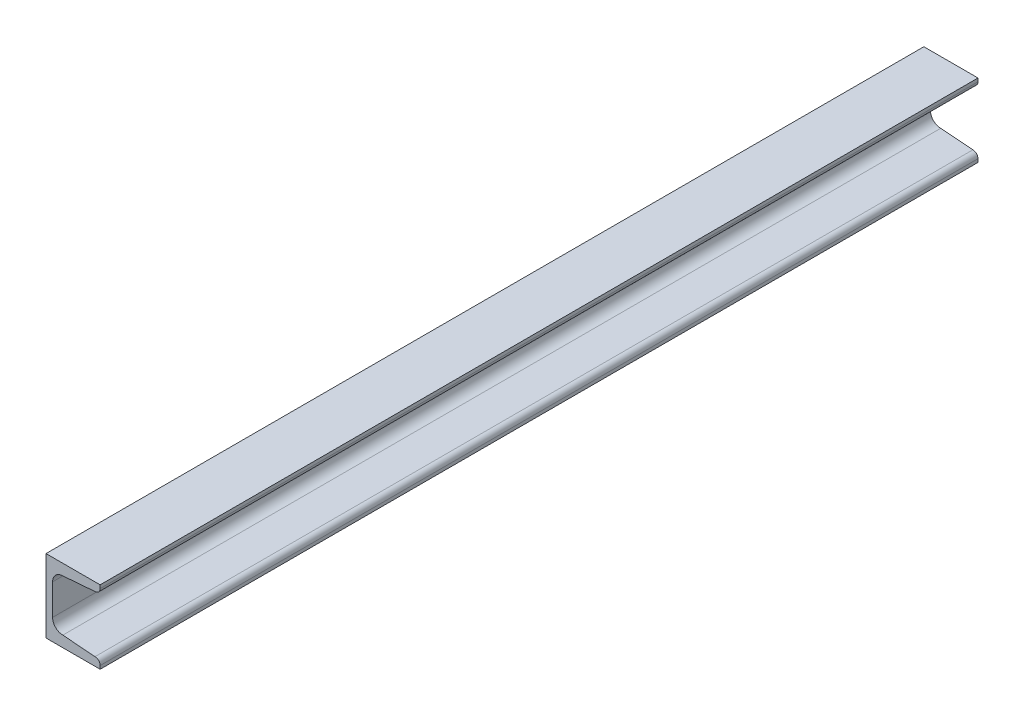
SolidWorks part; units mm, degrees
ref_plane "前视基准面" through (0, 0, 0) normal (0, 0, 1) x (1, 0, 0)
ref_plane "上视基准面" through (0, 0, 0) normal (0, 1, 0) x (1, 0, 0)
ref_plane "右视基准面" through (0, 0, 0) normal (1, 0, 0) x (0, 0, -1)
sketch "草图1" plane through (0, 0, 0) normal (0, 0, 1) x (1, 0, 0)
  line L0 (0, 0) -> (0, 50)
  line L1 (0, 25) -> (0, 0)
  line L2 (37, 0) -> (37, 2.225)
  line L3 (37, 2.225) -> (37, 0)
  line L4 (0, 0) -> (37, 0)
  line L5 (0, 25) -> (4.5, 25) construction
  line L6 (4.5, 35.525) -> (4.5, 14.475)
  line L7 (11.5, 7.475) -> (33.5, 5.725)
  line L8 (0, 50) -> (37, 50)
  line L9 (37, 50) -> (37, 47.775)
  line L10 (11.5, 42.525) -> (33.5, 44.275)
  arc A0 (4.5, 14.475) -> (11.5, 7.475) centre (11.5, 14.475) ccw
  arc A1 (37, 2.225) -> (33.5, 5.725) centre (33.5, 2.225) ccw
  arc A2 (37, 47.775) -> (33.5, 44.275) centre (33.5, 47.775) cw
  arc A3 (4.5, 35.525) -> (11.5, 42.525) centre (11.5, 35.525) cw
  point P5 (7, 0)
  point P7 (3.0436, 0)
  point P20 (8.7686, 0)
  point P21 (0, 4.1903)
  point P22 (0, 3.7153)
  point P23 (-11.2467, 57.0208)
  point P25 (-12.5718, 7.0208)
  dimension "D6" = 7
  dimension "D7" = 3.5
  dimension "D1" = 25
  dimension "D2" = 37
  dimension "D3" = 7
  dimension "D4" = 5.725
  dimension "D5" = 4.5
  dimension "D8" = 2.225
  dimension "D9" = 0.475
  dimension "D10" = 7.475
  dimension "D11" = 14.475
  dimension "D12" = 33.5
  dimension "D1x2" = 50
extrude "拉伸1" add sketch "草图1" along normal blind 600 contours L6 A3 L10 A2 L9 L8 L0 L4 L2 A1 L7 A0 | L5 L6 A3 L10 A2 L9 L8 L0
sketch "草图2" plane through (0, 0, 0) normal (0, 1, 0) x (1, 0, 0)
  line L0 (0, 0) -> (0, -600)
  dimension "D1" = 600
equation "\"D4@草图1\" = \"D3@草图1\" - \"D2@草图1\" * 0.05  + \"D5@草图1\" * 0.05 + \"D7@草图1\" * 0.1"
equation "\"D8@草图1\" = \"D4@草图1\" - \"D7@草图1\""
equation "\"D9@草图1\" = \"D2@草图1\" * 0.05 - \"D5@草图1\" * 0.15 - \"D6@草图1\" * 0.1"
equation "\"D10@草图1\" = \"D3@草图1\" + \"D9@草图1\""
equation "\"D11@草图1\" = \"D10@草图1\" + \"D6@草图1\""
equation "\"D12@草图1\" = \"D2@草图1\" - \"D7@草图1\""
equation "\"D1@草图1\" = \"D1x2@草图1\" / 2"
equation "\"D1@草图2\" = \"D1@拉伸1\""
